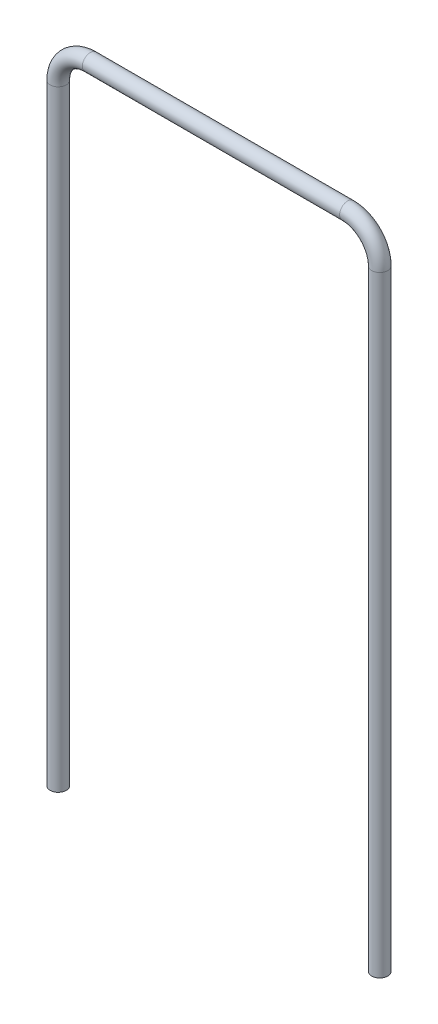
SolidWorks part; units mm, degrees
ref_plane "Piano frontale" through (0, 0, 0) normal (0, 0, 1) x (1, 0, 0)
ref_plane "Piano superiore" through (0, 0, 0) normal (0, 1, 0) x (1, 0, 0)
ref_plane "Piano destro" through (0, 0, 0) normal (1, 0, 0) x (0, 0, -1)
sketch "Schizzo1" plane through (0, 0, 0) normal (0, 0, 1) x (1, 0, 0)
  line L0 (-50, 0) -> (-50, 190)
  line L1 (50, 190) -> (50, 0)
  line L2 (-50, 0) -> (50, 0) construction
  line L3 (-40, 200) -> (40, 200)
  arc A0 (-50, 190) -> (-40, 200) centre (-40, 190) cw
  arc A1 (40, 200) -> (50, 190) centre (40, 190) cw
  dimension "D3" = 10
  dimension "D1" = 200
  dimension "D2" = 100
sketch "Schizzo2" plane through (0, 0, 0) normal (0, 1, 0) x (1, 0, 0)
  line L0 (-50, 0) -> (-50, 38.8956) construction
  circle A0 centre (-50, 0) radius 2.5
  dimension "D1" = 5
sweep "Sweep1" add profiles "Schizzo2" path "Schizzo1"
